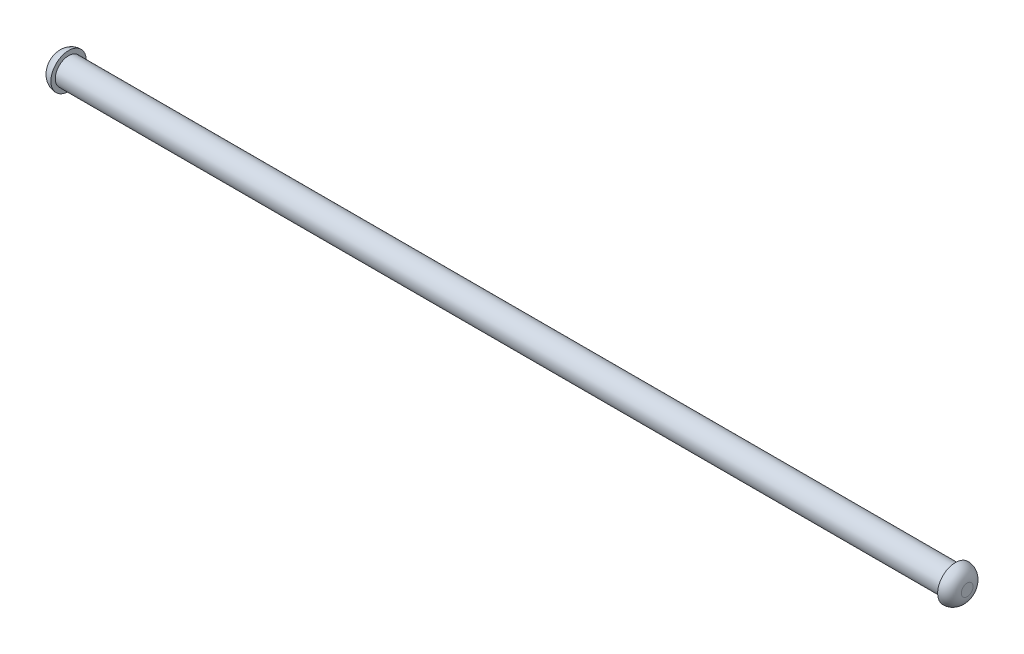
SolidWorks part; units mm, degrees
ref_plane "Front Plane" through (0, 0, 0) normal (0, 0, 1) x (1, 0, 0)
ref_plane "Top Plane" through (0, 0, 0) normal (0, 1, 0) x (1, 0, 0)
ref_plane "Right Plane" through (0, 0, 0) normal (1, 0, 0) x (0, 0, -1)
sketch "Sketch1" plane through (0, 0, 0) normal (1, 0, 0) x (0, 0, -1)
  circle A0 centre (-1.2623, 7.1514) radius 11.25
  dimension "D1" = 22.5
extrude "Boss-Extrude5" add sketch "Sketch1" along normal blind 750 contours A0
sketch "Sketch2" plane through (750, 0, 0) normal (1, 0, 0) x (0, 0, -1)
  circle A0 centre (-1.2623, 7.1514) radius 15
  dimension "D1" = 30
extrude "Boss-Extrude7" add sketch "Sketch2" along normal blind 10
fillet "Fillet1" radius 10 1 edges at (760, 7.1514, -13.7377)
sketch "Sketch3" plane through (0, 0, 0) normal (-1, 0, 0) x (0, 0, 1)
  circle A0 centre (1.2528, 7.2063) radius 15
  dimension "D1" = 30
extrude "Boss-Extrude8" add sketch "Sketch3" along normal blind 10
fillet "Fillet2" radius 10 1 edges at (-10, 7.2063, 16.2528)
